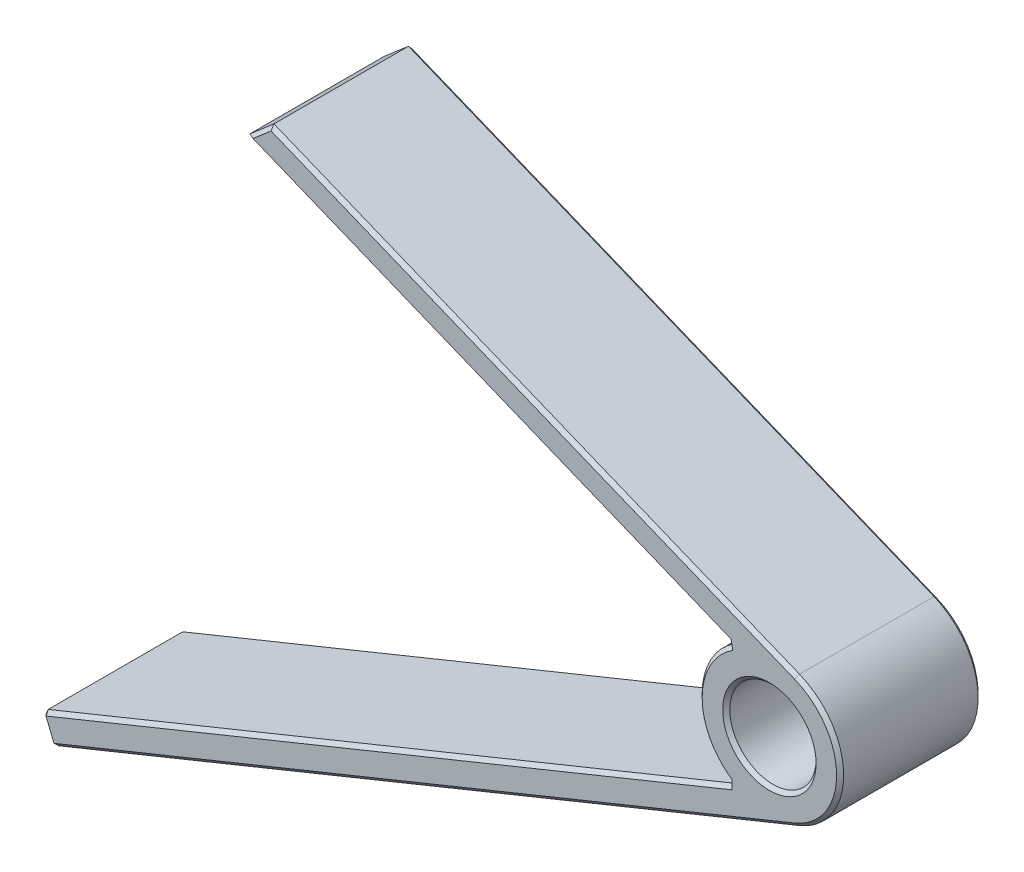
SolidWorks part; units mm, degrees
ref_plane "Спереди" through (0, 0, 0) normal (0, 0, 1) x (1, 0, 0)
ref_plane "Сверху" through (0, 0, 0) normal (0, 1, 0) x (1, 0, 0)
ref_plane "Справа" through (0, 0, 0) normal (1, 0, 0) x (0, 0, -1)
sketch "Эскиз1" plane through (0, 0, 0) normal (0, 0, 1) x (1, 0, 0)
  line L0 (0, 0) -> (-54.0377, 0) construction
  line L1 (-35.2543, 19.7382) -> (1.884, 4.6315)
  line L2 (-50.6864, -26.0155) -> (1.884, -4.6315)
  line L3 (-36.96, 18.2729) -> (-2.5748, 4.2861)
  line L4 (-51.44, -24.1629) -> (-2.5748, -4.2861)
  line L5 (-51.44, -24.1629) -> (1.1304, -2.7789) construction
  line L6 (-51.44, 24.1629) -> (1.1304, 2.7789) construction
  line L7 (-51.44, -24.1629) -> (-50.6864, -26.0155)
  line L8 (-35.2543, 19.7382) -> (-36.96, 18.2729)
  line L9 (-50.6864, 26.0155) -> (1.884, 4.6315) construction
  circle A0 centre (0, 0) radius 3.05
  arc A1 (1.884, -4.6315) -> (1.884, 4.6315) centre (0, 0) ccw
  arc A2 (-2.5748, 4.2861) -> (-2.5748, -4.2861) centre (0, 0) ccw
  dimension "D1" = 6.1
  dimension "D2" = 10
  dimension "D3" = 44.27
  dimension "D6" = 51.44
  dimension "D7" = 62.8
  dimension "D8" = 22.135
  dimension "D9" = 36.96
  dimension "D4" = 2
  dimension "D5" = 2
extrude "Бобышка-Вытянуть1" add sketch "Эскиз1" along normal blind 10
chamfer "Фаска1" distance 0.25 angle 45 22 edges at (3.05, 0, 0) (3.05, 0, 10) (-51.44, -24.1629, 5) (-16.6852, 12.1849, 0) (-36.1072, 19.0056, 0) (-19.7674, 11.2795, 0) (-5, 0, 0) (-27.0074, -14.2245, 0) (-51.0632, -25.0892, 0) (5, 0, 0) (-24.4012, -15.3235, 0) (-50.6864, -26.0155, 5) (-24.4012, -15.3235, 10) (-51.0632, -25.0892, 10) (-27.0074, -14.2245, 10) (-5, 0, 10) (-19.7674, 11.2795, 10) (-36.1072, 19.0056, 10) (-16.6852, 12.1849, 10) (5, 0, 10) (-2.5748, 4.2861, 5) (-2.5748, -4.2861, 5)
